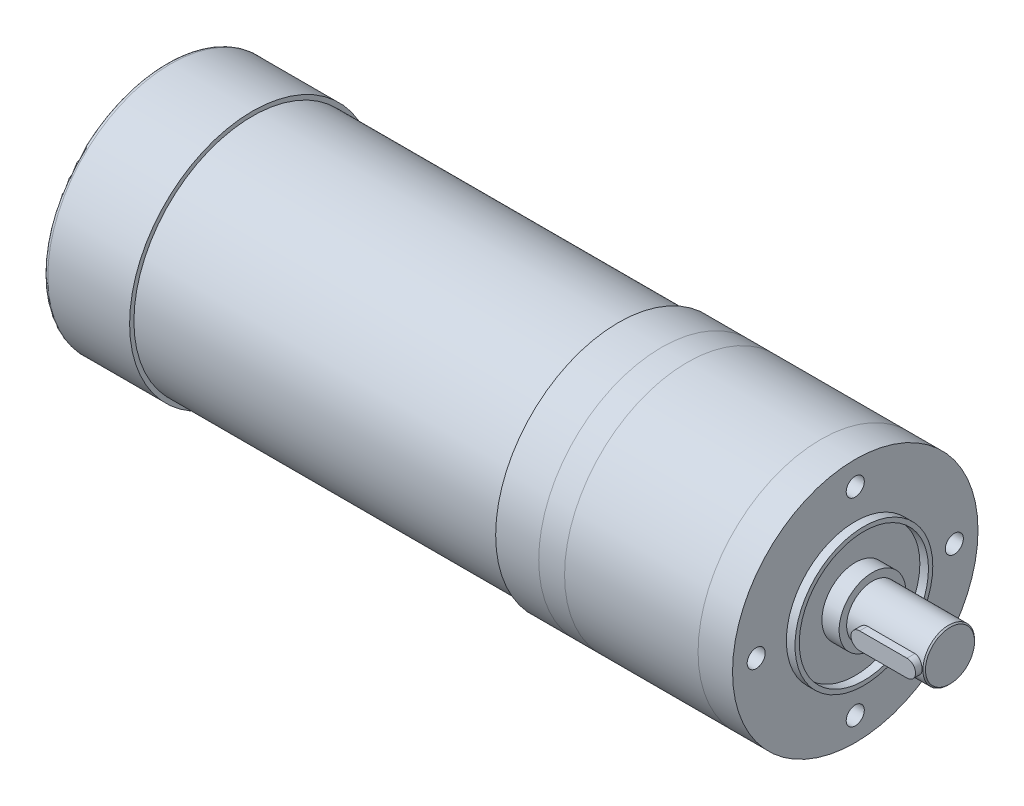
SolidWorks part; units mm, degrees
ref_plane "前视基准面" through (0, 0, 0) normal (0, 0, 1) x (1, 0, 0)
ref_plane "上视基准面" through (0, 0, 0) normal (0, 1, 0) x (1, 0, 0)
ref_plane "右视基准面" through (0, 0, 0) normal (1, 0, 0) x (0, 0, -1)
sketch "草图1" plane through (0, 0, 0) normal (1, 0, 0) x (0, 0, -1)
  circle A0 centre (0, 0) radius 28.5
extrude "凸台-拉伸1" add sketch "草图1" against normal blind 8
sketch "草图2" plane through (-8, 0, 0) normal (-1, 0, 0) x (0, 0, 1)
  circle A0 centre (0, 0) radius 28.5
extrude "凸台-拉伸2" add sketch "草图2" along normal blind 31 separate body
sketch "草图3" plane through (-39, 0, 0) normal (-1, 0, 0) x (0, 0, 1)
  circle A0 centre (0, 0) radius 28.5
extrude "凸台-拉伸3" add sketch "草图3" along normal blind 6 separate body
sketch "草图4" plane through (-45, 0, 0) normal (-1, 0, 0) x (0, 0, 1)
  circle A0 centre (0, 0) radius 28.5
extrude "凸台-拉伸4" add sketch "草图4" along normal blind 10 separate body
sketch "草图5" plane through (-55, 0, 0) normal (-1, 0, 0) x (0, 0, 1)
  circle A0 centre (0, 0) radius 27.5
extrude "凸台-拉伸5" add sketch "草图5" along normal blind 85
sketch "草图6" plane through (-140, 0, 0) normal (-1, 0, 0) x (0, 0, 1)
  circle A0 centre (0, 0) radius 28.5
extrude "凸台-拉伸6" add sketch "草图6" along normal blind 20
fillet "圆角1" radius 1 1 edges at (-160, 0, 28.5)
sketch "草图7" plane through (0, 0, 0) normal (1, 0, 0) x (0, 0, -1)
  circle A0 centre (0, 0) radius 16
  circle A1 centre (0, 0) radius 15
extrude "凸台-拉伸7" add sketch "草图7" along normal blind 2
sketch "草图8" plane through (0, 0, 0) normal (1, 0, 0) x (0, 0, -1)
  circle A0 centre (0, 0) radius 7.75
extrude "凸台-拉伸8" add sketch "草图8" along normal blind 4
sketch "草图9" plane through (4, 0, 0) normal (1, 0, 0) x (0, 0, -1)
  circle A0 centre (0, 0) radius 6
extrude "凸台-拉伸9" add sketch "草图9" along normal blind 18
sketch "草图10" plane through (0, 0, 0) normal (1, 0, 0) x (0, 0, -1)
  point P3 (0, 23)
  point P4 (23, 0)
  point P5 (0, -23)
  point P6 (-23, 0)
hole_wizard "M5 螺纹孔1" positions "3D草图1" profile "草图11" tap size "M5" standard "GB"
sketch3d "3D草图1"
  point P0 (0, 23, 0)
  point P3 (0, 0, -23)
  point P6 (0, -23, 0)
  point P9 (0, 0, 23)
sketch "草图11" plane through (0, 23, 0) normal (0, 1, 0) x (0, 0, -1)
  line L0 (0, 0) -> (0, 15.2618)
  line L1 (0, 15.2618) -> (2.1, 14)
  line L2 (2.1, 14) -> (2.1, 0)
  line L5 (2.1, 0) -> (0, 0)
  line L10 (0, 15.2618) -> (-2.1, 14) construction
  line L11 (0, -6.35) -> (0, 107.95) construction
  dimension "螺纹孔钻头直径" = 4.2
  dimension "螺纹孔钻头深度" = 14
  dimension "导头角度" = 118
ref_plane "基准面1" through (0, 0, 6) normal (0, 0, 1) x (1, 0, 0)
sketch "草图12" plane through (0, 0, 6) normal (0, 0, 1) x (1, 0, 0)
  line L3 (8.5, 2) -> (19.5, 2)
  line L5 (19.5, -2) -> (8.5, -2)
  arc A0 (19.5, -2) -> (19.5, 2) centre (19.5, 0) ccw
  arc A1 (8.5, 2) -> (8.5, -2) centre (8.5, 0) ccw
extrude "切除-拉伸1" cut sketch "草图12" against normal blind 2.5
sketch "草图13" plane through (0, 0, 3.5) normal (0, 0, 1) x (1, 0, 0)
  line L0 (8.5, 2) -> (19.5, 2)
  line L2 (19.5, -2) -> (8.5, -2)
  arc A0 (8.5, 2) -> (8.5, -2) centre (8.5, 0) ccw
  arc A1 (19.5, -2) -> (19.5, 2) centre (19.5, 0) ccw
extrude "凸台-拉伸10" add sketch "草图13" along normal blind 4 separate body
chamfer "倒角1" distance 0.3 angle 45 1 edges at (22, 0, -6)
